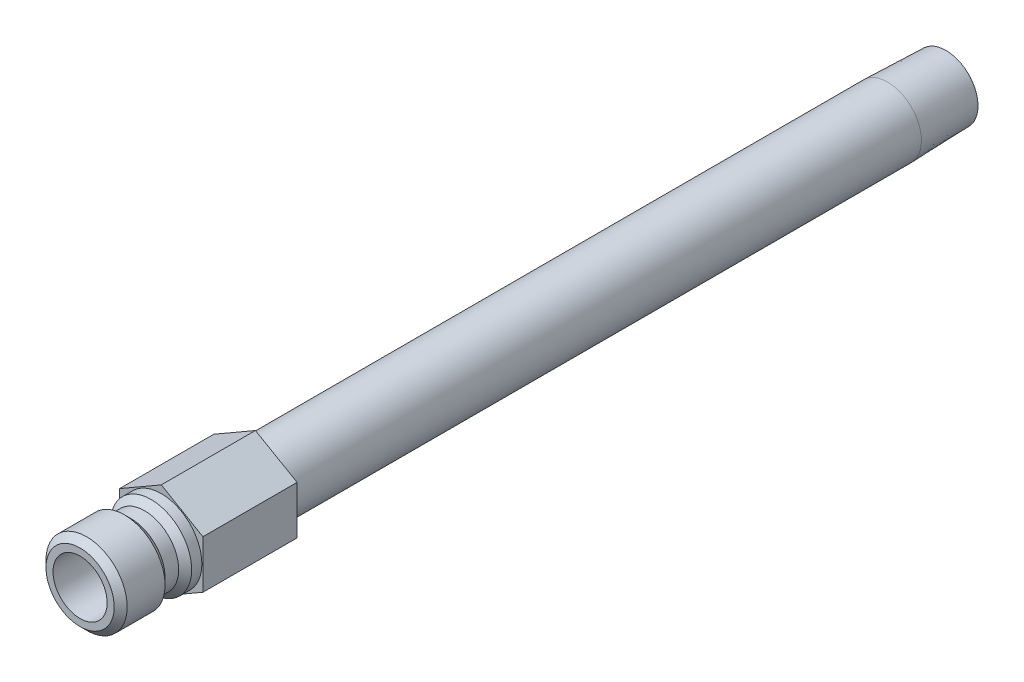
SolidWorks part; units mm, degrees
ref_plane "Front Plane" through (0, 0, 0) normal (0, 0, 1) x (1, 0, 0)
ref_plane "Top Plane" through (0, 0, 0) normal (0, 1, 0) x (1, 0, 0)
ref_plane "Right Plane" through (0, 0, 0) normal (1, 0, 0) x (0, 0, -1)
sketch "Sketch1" plane through (0, 0, 0) normal (1, 0, 0) x (0, 0, -1)
  line L0 (0, 0) -> (-12.7, 0) construction
  line L1 (-9.525, 3.175) -> (-9.525, 4.0005)
  line L2 (-3.556, 4.0005) -> (-3.556, 0) construction
  line L3 (-8.763, 4.7625) -> (-4.318, 4.7625)
  line L4 (0, 3.9688) -> (0, 3.175) construction
  line L5 (-3.556, 4.0005) -> (-1.9558, 4.0005)
  line L6 (-1.1938, 4.7625) -> (0, 4.7625)
  line L7 (0, 4.7625) -> (0, 3.9688)
  line L8 (-3.556, 4.0005) -> (-4.318, 4.7625)
  line L9 (-1.9558, 4.0005) -> (-1.1938, 4.7625)
  line L10 (-9.525, 4.0005) -> (-8.763, 4.7625)
  line L11 (0.127, 3.175) -> (0.127, 2.3813)
  line L12 (0, 3.9688) -> (85.217, 3.9688)
  line L13 (85.217, 3.9688) -> (92.075, 3.7544)
  line L14 (92.075, 3.7544) -> (92.075, 2.3813)
  line L15 (0, 0) -> (11.049, 0) construction
  line L16 (11.049, 0) -> (11.049, 4.7625) construction
  line L17 (11.049, 4.7625) -> (0, 4.7625) construction
  line L19 (0.127, 3.175) -> (-9.525, 3.175)
  line L20 (0.127, 2.3813) -> (92.075, 2.3813)
  line L21 (0, 2.6543) -> (0, 0) construction
  dimension "D1" = 9.525
  dimension "D2" = 1.6002
  dimension "D3" = 0.762
  dimension "D4" = 45
  dimension "D5" = 5.969
  dimension "D6" = 45
  dimension "D7" = 1.79
  dimension "D8" = 6.858
  dimension "D9" = 101.6
  dimension "D10" = 3.175
  dimension "D11" = 20.574
  dimension "D12" = 6.35
  dimension "D13" = 4.7625
  dimension "D14" = 9.525
  dimension "D15" = 7.9375
  dimension "D16" = 9.652
revolve "Revolve1" add sketch "Sketch1" angle 360 about L0
sketch "Sketch2" plane through (0, 0, 0) normal (0, 0, 1) x (1, 0, 0)
  line L1 (-4.8895, 2.823) -> (-4.8895, -2.823)
  line L2 (-4.8895, -2.823) -> (0, -5.6459)
  line L3 (0, -5.6459) -> (4.8895, -2.823)
  line L4 (4.8895, -2.823) -> (4.8895, 2.823)
  line L5 (4.8895, 2.823) -> (0, 5.6459)
  line L6 (0, 5.6459) -> (-4.8895, 2.823)
  circle A0 centre (0, 0) radius 4.8895 construction
  circle A1 centre (0, 0) radius 2.3812 construction
  circle A2 centre (0, 0) radius 2.3812
  dimension "D1" = 9.779
extrude "Boss-Extrude1" add sketch "Sketch2" against normal up to vertex (11.049 mm away) from vertex at 0
